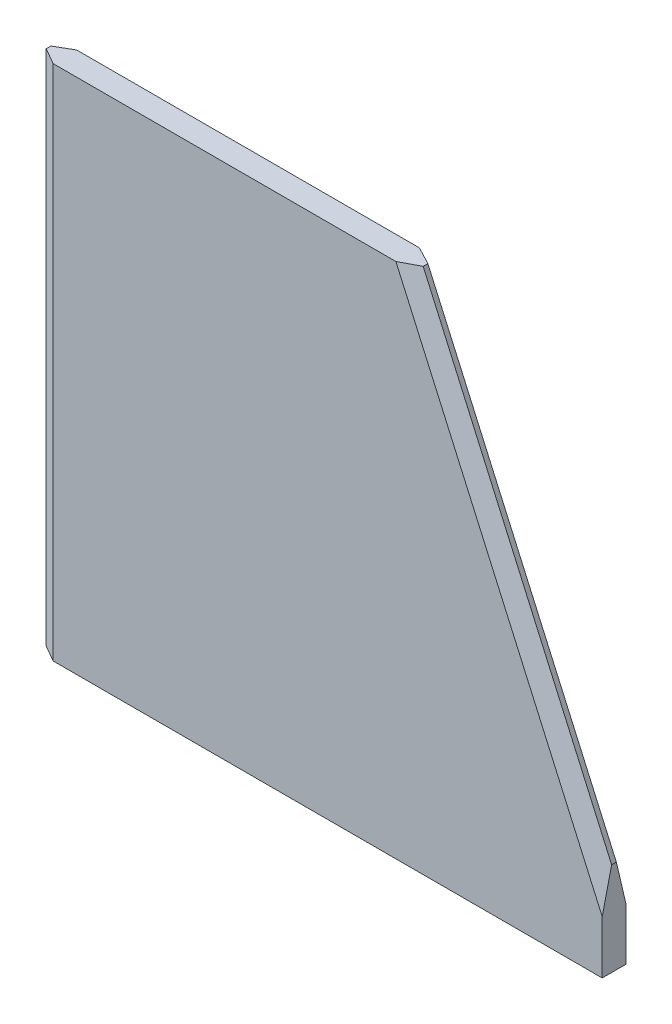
SolidWorks part; units mm, degrees
ref_plane "Front Plane" through (0, 0, 0) normal (0, 0, 1) x (1, 0, 0)
ref_plane "Top Plane" through (0, 0, 0) normal (0, 1, 0) x (1, 0, 0)
ref_plane "Right Plane" through (0, 0, 0) normal (1, 0, 0) x (0, 0, -1)
sketch "Sketch1" plane through (0, 0, 0) normal (0, 0, 1) x (1, 0, 0)
  line L0 (0, 0) -> (76.2, 0)
  line L1 (76.2, 0) -> (76.2, 12.573)
  line L3 (0, 12.573) -> (0, 0)
  line L4 (0, 12.573) -> (0, 69.723)
  line L5 (0, 69.723) -> (50.8, 69.723)
  line L9 (50.8, 69.723) -> (76.2, 12.573)
  dimension "D1" = 57.15
  dimension "D2" = 12.573
  dimension "D3" = 76.2
  dimension "D4" = 50.8
  dimension "D5" = 25.4
extrude "Boss-Extrude1" add sketch "Sketch1" along normal blind 3.175
chamfer "Chamfer1" distance 1.27 angle 60 2 edges at (63.5, 41.148, 0) (63.5, 41.148, 3.175)
chamfer "Chamfer2" distance 1.27 angle 60 2 edges at (0, 34.8615, 0) (0, 34.8615, 3.175)
